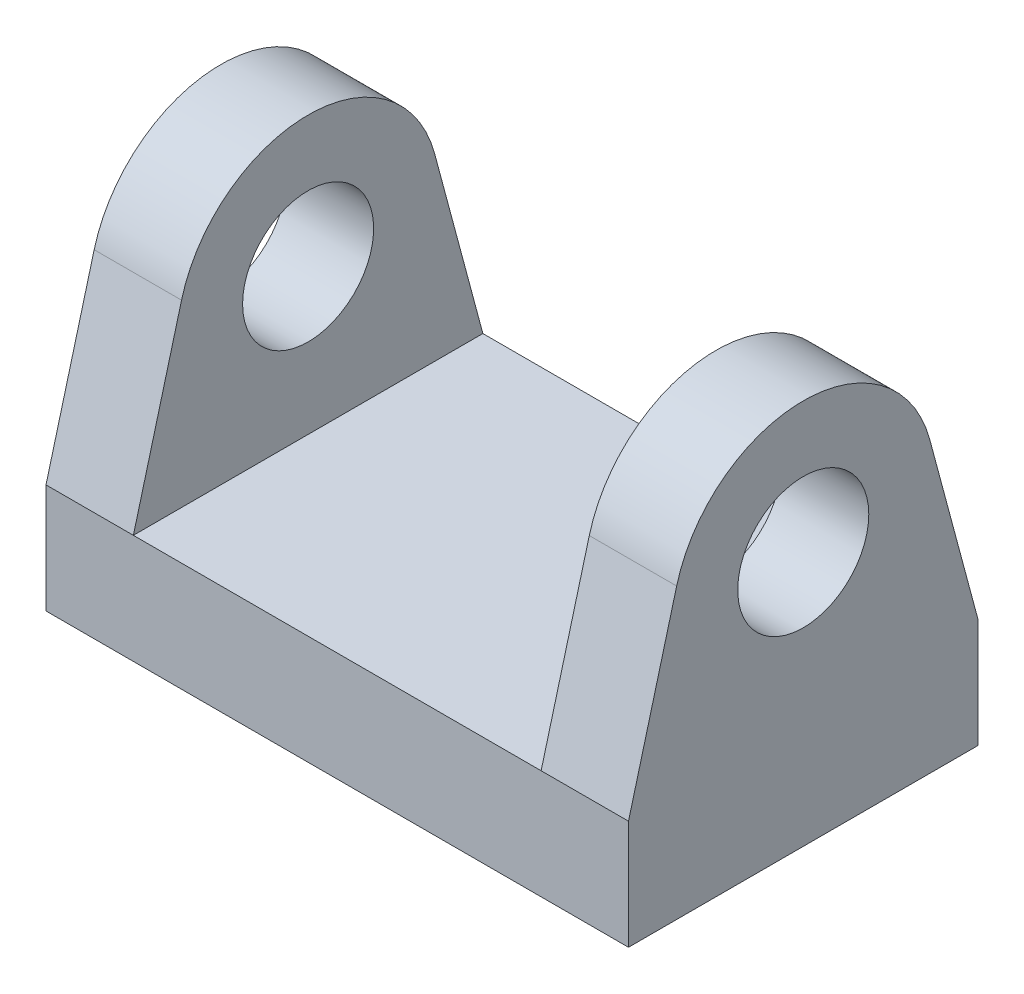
SolidWorks part; units mm, degrees
ref_plane "Front Plane" through (0, 0, 0) normal (0, 0, 1) x (1, 0, 0)
ref_plane "Top Plane" through (0, 0, 0) normal (0, 1, 0) x (1, 0, 0)
ref_plane "Right Plane" through (0, 0, 0) normal (1, 0, 0) x (0, 0, -1)
ref_plane "Plane1" through (14, 0, 0) normal (1, 0, 0) x (0, 0, -1)
sketch "Sketch1" plane through (14, 0, 0) normal (1, 0, 0) x (0, 0, -1)
  line L0 (-8.6928, 19.8314) -> (-12, 7.5)
  line L1 (-12, 7.5) -> (12, 7.5)
  line L2 (12, 7.5) -> (8.6928, 19.8314)
  arc A0 (8.6928, 19.8314) -> (-8.6928, 19.8314) centre (0, 17.5) ccw
extrude "Boss-Extrude1" add sketch "Sketch1" against normal blind 28
sketch "Sketch2" plane through (0, 7.5, 0) normal (0, -1, 0) x (1, 0, 0)
  line L0 (-14, 12) -> (14, 12)
  line L1 (14, 12) -> (14, -12)
  line L2 (14, -12) -> (-14, -12)
  line L3 (-14, -12) -> (-14, 12)
extrude "Boss-Extrude2" add sketch "Sketch2" along normal blind 7.5
sketch "Sketch3" plane through (-14, 0, 0) normal (-1, 0, 0) x (0, 0, 1)
  line L0 (12, 0) -> (-12, 0)
  line L1 (-12, 0) -> (-12, 7.5)
  line L2 (-12, 7.5) -> (-8.6928, 19.8314)
  line L3 (8.6928, 19.8314) -> (12, 7.5)
  line L4 (12, 7.5) -> (12, 0)
  arc A0 (-8.6928, 19.8314) -> (8.6928, 19.8314) centre (0, 17.5) cw
extrude "Boss-Extrude3" add sketch "Sketch3" along normal blind 6
sketch "Sketch4" plane through (14, 0, 0) normal (1, 0, 0) x (0, 0, -1)
  line L0 (12, 0) -> (-12, 0)
  line L1 (-12, 0) -> (-12, 7.5)
  line L2 (-12, 7.5) -> (-8.6928, 19.8314)
  line L3 (8.6928, 19.8314) -> (12, 7.5)
  line L4 (12, 7.5) -> (12, 0)
  arc A0 (-8.6928, 19.8314) -> (8.6928, 19.8314) centre (0, 17.5) cw
extrude "Boss-Extrude4" add sketch "Sketch4" along normal blind 6
ref_plane "Plane2" through (-14, 0, 0) normal (-1, 0, 0) x (0, 0, 1)
sketch "Sketch9" plane through (-14, 0, 0) normal (-1, 0, 0) x (0, 0, 1)
  line L0 (12, 7.5) -> (8.6928, 19.8314)
  line L1 (-8.6928, 19.8314) -> (-12, 7.5)
  line L2 (-12, 7.5) -> (12, 7.5)
  arc A0 (8.6928, 19.8314) -> (-8.6928, 19.8314) centre (0, 17.5) ccw
extrude "Cut-Extrude1" cut sketch "Sketch9" against normal blind 28
hole_wizard "Ø9.0 (9) Diameter Hole1" positions "Sketch11" profile "Sketch10" hole size "Ø9.0" standard "ANSI Metric"
sketch "Sketch11" plane through (20, 0, 0) normal (1, 0, 0) x (0, 0, -1)
  point P0 (0, 17.5)
sketch "Sketch10" plane through (20, 17.5, 0) normal (0, 1, 0) x (0, 0, -1)
  line L0 (0, 0) -> (0, 6)
  line L1 (0, 6) -> (4.5, 6)
  line L2 (4.5, 6) -> (4.5, 0)
  line L5 (4.5, 0) -> (0, 0)
  line L11 (0, -6.35) -> (0, 107.95) construction
  dimension "Thru Hole Dia." = 9
  dimension "Thru Hole Depth" = 6
hole_wizard "Ø9.0 (9) Diameter Hole2" positions "Sketch13" profile "Sketch12" hole size "Ø9.0" standard "ANSI Metric"
sketch "Sketch13" plane through (-20, 0, 0) normal (-1, 0, 0) x (0, 0, 1)
  point P0 (0, 17.5)
sketch "Sketch12" plane through (-20, 17.5, 0) normal (0, 1, 0) x (0, 0, 1)
  line L0 (0, 0) -> (0, 40)
  line L1 (0, 40) -> (4.5, 40)
  line L2 (4.5, 40) -> (4.5, 0)
  line L5 (4.5, 0) -> (0, 0)
  line L11 (0, -6.35) -> (0, 107.95) construction
  dimension "Thru Hole Dia." = 9
  dimension "Thru Hole Depth" = 40
